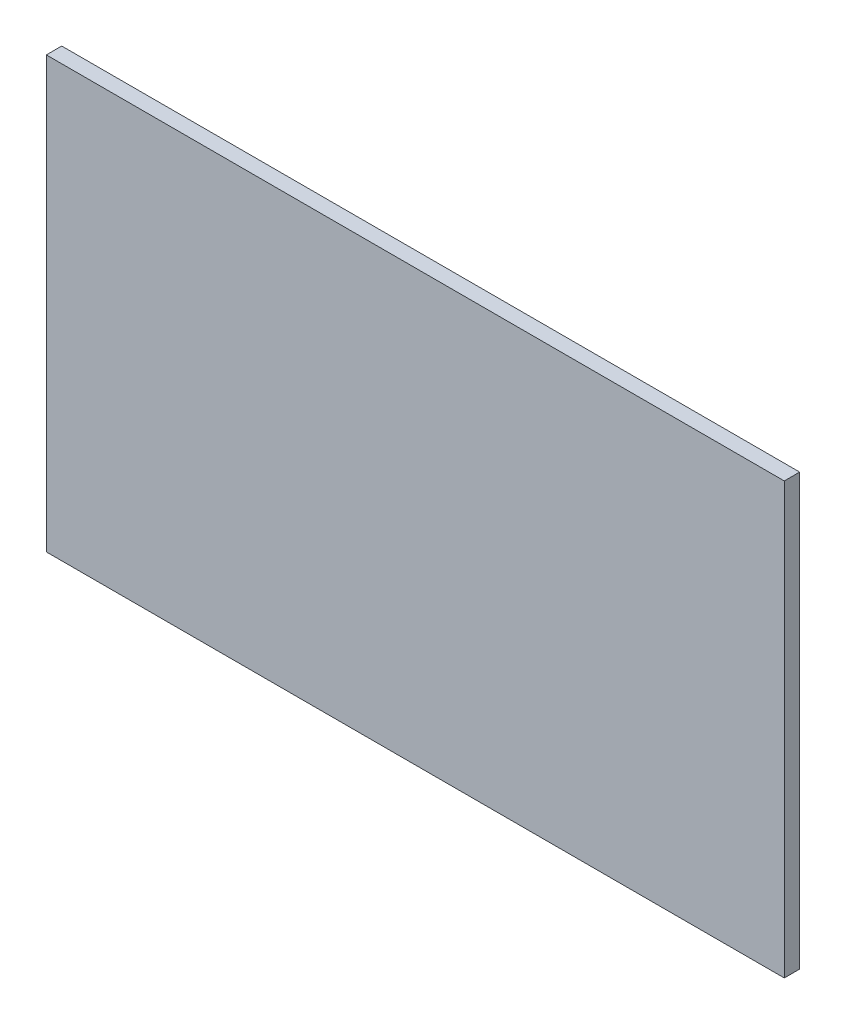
SolidWorks part; units mm, degrees
ref_plane "Front Plane" through (0, 0, 0) normal (0, 0, 1) x (1, 0, 0)
ref_plane "Top Plane" through (0, 0, 0) normal (0, 1, 0) x (1, 0, 0)
ref_plane "Right Plane" through (0, 0, 0) normal (1, 0, 0) x (0, 0, -1)
sketch "Sketch2" plane through (0, 0, 0) normal (0, 0, 1) x (1, 0, 0)
  line L1 (0, 0) -> (609.6, 0)
  line L2 (0, 0) -> (0, 355.6)
  line L3 (0, 355.6) -> (609.6, 355.6)
  line L4 (609.6, 0) -> (609.6, 355.6)
  dimension "D1" = 355.6
  dimension "D2" = 609.6
extrude "Boss-Extrude1" add sketch "Sketch2" along normal blind 12.7
